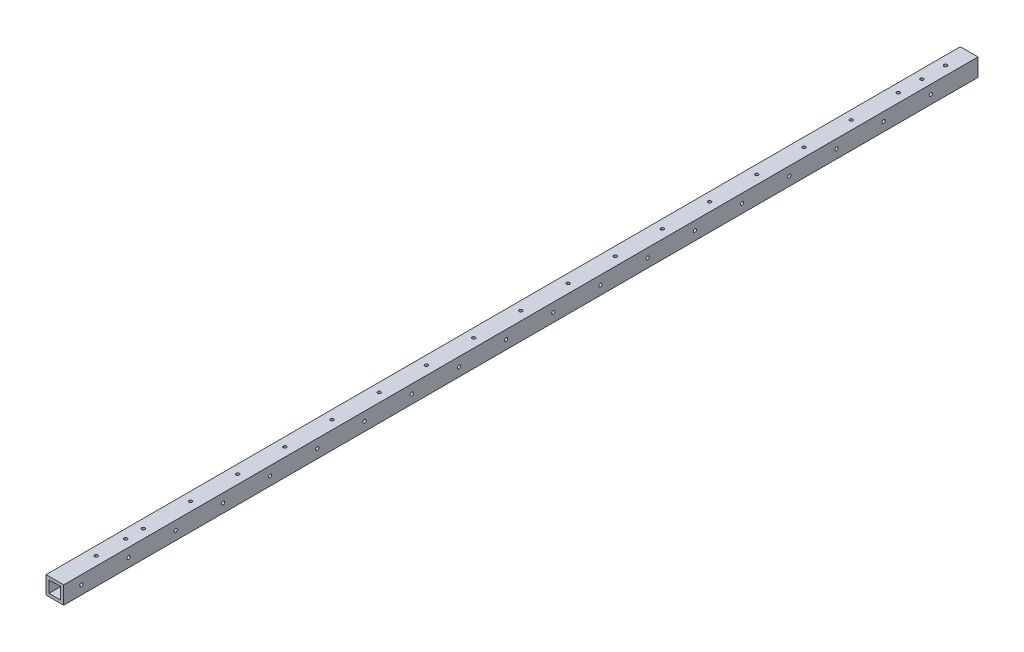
SolidWorks part; units mm, degrees
ref_plane "Front Plane" through (0, 0, 0) normal (0, 0, 1) x (1, 0, 0)
ref_plane "Top Plane" through (0, 0, 0) normal (0, 1, 0) x (1, 0, 0)
ref_plane "Right Plane" through (0, 0, 0) normal (1, 0, 0) x (0, 0, -1)
sketch "Sketch1" plane through (0, 0, 0) normal (0, 0, 1) x (1, 0, 0)
  line L0 (9.525, -9.525) -> (-9.525, 9.525) construction
  line L1 (-9.525, 9.525) -> (9.525, 9.525)
  line L2 (-9.525, 9.525) -> (-9.525, -9.525)
  line L3 (-9.525, -9.525) -> (9.525, -9.525)
  line L4 (9.525, 9.525) -> (9.525, -9.525)
  line L5 (-6.35, 6.35) -> (6.35, 6.35)
  line L6 (6.35, 6.35) -> (6.35, -6.35)
  line L7 (-6.35, -6.35) -> (6.35, -6.35)
  line L8 (-6.35, 6.35) -> (-6.35, -6.35)
  dimension "D1" = 3.175
  dimension "D2" = 19.05
ref_plane "Plane1" through (-82.55, 82.55, -42.8625) normal (-1, 0, 0) x (0, -1, 0)
ref_plane "Plane2" through (-82.55, 82.55, -42.8625) normal (-1, 0, 0) x (0, -1, 0)
ref_plane "Plane3" through (-82.55, 82.55, -42.8625) normal (-1, 0, 0) x (0, -1, 0)
ref_plane "Plane4" through (-82.55, 82.55, -42.8625) normal (-1, 0, 0) x (0, -1, 0)
ref_plane "Plane5" through (-82.55, 82.55, -42.8625) normal (-1, 0, 0) x (0, -1, 0)
ref_plane "Plane6" through (-82.55, 82.55, 936.625) normal (-1, 0, 0) x (0, 1, 0)
ref_plane "Plane7" through (-82.55, 82.55, 936.625) normal (-1, 0, 0) x (0, 1, 0)
extrude "Extrude1" add sketch "Sketch1" along normal blind 984.25
hole_wizard "#8-32 Tapped Hole1" positions "Sketch3" profile "Sketch2" tap size "#8-32" standard "Ansi Inch"
sketch "Sketch3" plane through (0, 9.525, 0) normal (0, 1, 0) x (-1, 0, 0)
  point P0 (0, 25.4)
  dimension "D1" = 25.4
sketch "Sketch2" plane through (0, 9.525, 25.4) normal (1, 0, 0) x (0, 0, 1)
  line L0 (0, 0) -> (0, 19.05)
  line L1 (0, 19.05) -> (1.7272, 19.05)
  line L2 (1.7272, 19.05) -> (1.7272, 0)
  line L5 (1.7272, 0) -> (0, 0)
  line L11 (0, -6.35) -> (0, 107.95) construction
  dimension "Thru Tap Drill Dia." = 3.4544
  dimension "Thru Tap Drill Depth" = 19.05
hole_wizard "#8-32 Tapped Hole2" positions "Sketch5" profile "Sketch4" tap size "#8-32" standard "Ansi Inch"
sketch "Sketch5" plane through (-9.525, 0, 0) normal (-1, 0, 0) x (0, 0, 1)
  point P0 (50.8, 0)
  dimension "D1" = 50.8
sketch "Sketch4" plane through (-9.525, 0, 50.8) normal (0, 1, 0) x (0, 0, 1)
  line L0 (0, 0) -> (0, 19.05)
  line L1 (0, 19.05) -> (1.7272, 19.05)
  line L2 (1.7272, 19.05) -> (1.7272, 0)
  line L5 (1.7272, 0) -> (0, 0)
  line L11 (0, -6.35) -> (0, 107.95) construction
  dimension "Thru Tap Drill Dia." = 3.4544
  dimension "Thru Tap Drill Depth" = 19.05
pattern_linear "LPattern3" count 19 spacing 50.8 along (0, 0, 1) of "#8-32 Tapped Hole1"
pattern_linear "LPattern4" count 19 spacing 50.8 along (0, 0, 1) of "#8-32 Tapped Hole2"
hole_wizard "#8-32 Tapped Hole3" positions "Sketch7" profile "Sketch6" tap size "#8-32" standard "ANSI Inch"
sketch "Sketch7" plane through (0, 9.525, 0) normal (0, 1, 0) x (1, 0, 0)
  line L0 (9.525, -984.25) -> (-9.525, -984.25) construction
  point P0 (0, -50.8)
  point P2 (0, -908.05)
  dimension "D1" = 50.8
  dimension "D2" = 76.2
sketch "Sketch6" plane through (0, 9.525, 50.8) normal (1, 0, 0) x (0, 0, 1)
  line L0 (0, 0) -> (0, 19.05)
  line L1 (0, 19.05) -> (1.7272, 19.05)
  line L2 (1.7272, 19.05) -> (1.7272, 0)
  line L5 (1.7272, 0) -> (0, 0)
  line L11 (0, -6.35) -> (0, 107.95) construction
  dimension "Thru Tap Drill Dia." = 3.4544
  dimension "Thru Tap Drill Depth" = 19.05
